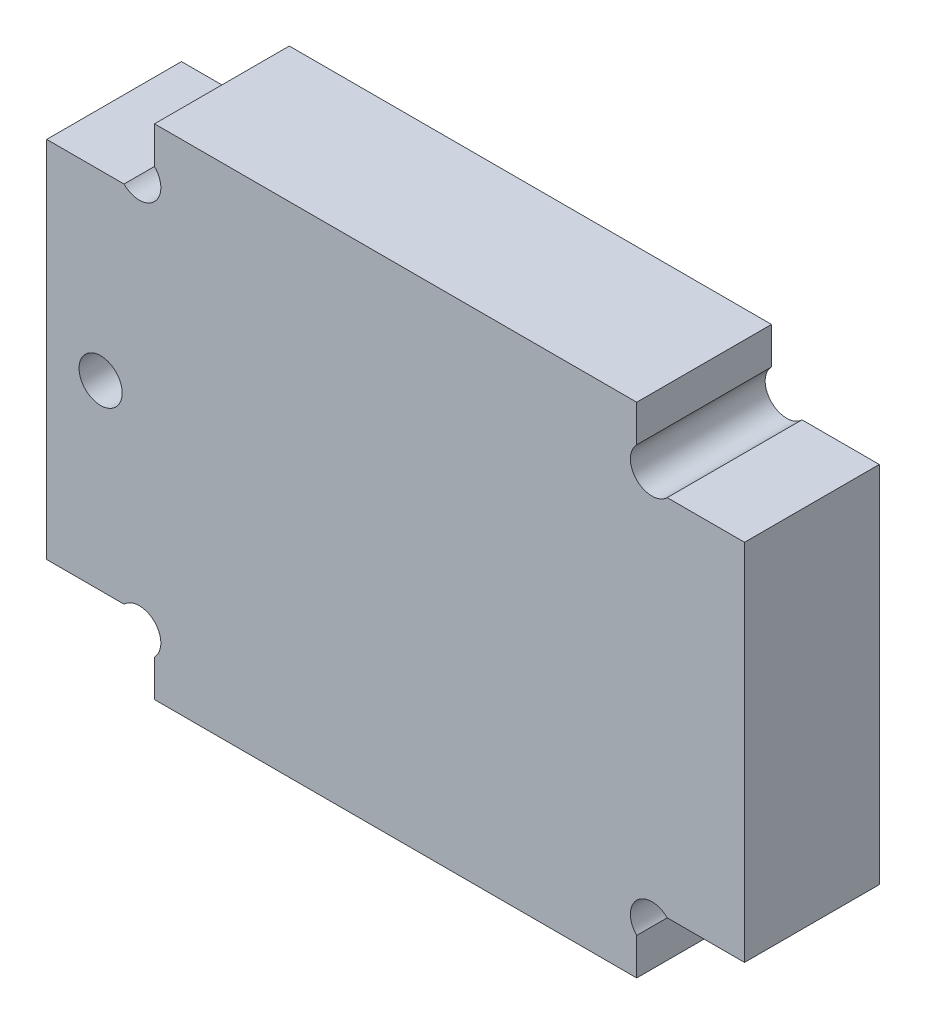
SolidWorks part; units mm, degrees
ref_plane "Plan de face" through (0, 0, 0) normal (0, 0, 1) x (1, 0, 0)
ref_plane "Plan de dessus" through (0, 0, 0) normal (0, 1, 0) x (1, 0, 0)
ref_plane "Plan de droite" through (0, 0, 0) normal (1, 0, 0) x (0, 0, -1)
sketch "Esquisse1" plane through (0, 0, 0) normal (0, 0, 1) x (1, 0, 0)
  line L0 (17.89, 18.5) -> (17.89, -18.5)
  line L1 (-17.89, 18.5) -> (17.89, 18.5)
  line L2 (-17.89, 18.5) -> (-17.89, -18.5)
  line L3 (-17.89, -18.5) -> (17.89, -18.5)
  line L5 (-17.89, 18.5) -> (17.89, -18.5) construction
  line L6 (-17.89, -18.5) -> (17.89, 18.5) construction
  point P0 (0, 0)
  dimension "D1" = 35.78
extrude "Boss.-Extru.1" add sketch "Esquisse1" along normal blind 10 contours L1 L0 L3 L2
sketch "Esquisse3" plane through (17.89, 0, 0) normal (1, 0, 0) x (0, 0, -1)
  line L0 (-10, 18.5) -> (0, 18.5) construction
  line L1 (-10, 13.5) -> (0, 13.5)
  line L2 (-10, 13.5) -> (-10, -13.5)
  line L3 (-10, -13.5) -> (0, -13.5)
  line L4 (0, 13.5) -> (0, -13.5)
  line L5 (0, 18.5) -> (0, -18.5) construction
  dimension "D1" = 10
  dimension "D2" = 27
  dimension "D3" = 5
  dimension "D4" = 0
extrude "Boss.-Extru.2" add sketch "Esquisse3" along normal blind 8
sketch "Esquisse4" plane through (-17.89, 0, 0) normal (-1, 0, 0) x (0, 0, 1)
  line L0 (0, 18.5) -> (0, -18.5) construction
  line L1 (0, 13.5) -> (10, 13.5)
  line L2 (0, 13.5) -> (0, -13.5)
  line L3 (0, -13.5) -> (10, -13.5)
  line L4 (10, 13.5) -> (10, -13.5)
  line L5 (10, 18.5) -> (0, 18.5) construction
  dimension "D1" = 10
  dimension "D2" = 5
  dimension "D3" = 27
extrude "Boss.-Extru.3" add sketch "Esquisse4" along normal blind 8
sketch "Esquisse5" plane through (0, 0, 10) normal (0, 0, 1) x (1, 0, 0)
  line L0 (-17.89, 13.5) -> (-22.368, 17.978) construction
  line L1 (-25.89, 13.5) -> (-17.89, 13.5) construction
  line L2 (-17.89, 18.5) -> (-17.89, 13.5) construction
  line L3 (-17.89, 15.7627) -> (-20.1527, 13.5)
  line L4 (0, -18.5) -> (0, 22.1261) construction
  line L5 (-17.89, -18.5) -> (17.89, -18.5) construction
  line L6 (25.89, 0) -> (-34.1231, 0) construction
  line L7 (25.89, 13.5) -> (25.89, -13.5) construction
  line L8 (17.89, 15.7627) -> (20.1527, 13.5)
  line L9 (-20.1527, -13.5) -> (-17.89, -15.7627)
  line L10 (20.1527, -13.5) -> (17.89, -15.7627)
  arc A0 (-17.89, 15.7627) -> (-20.1527, 13.5) centre (-19.0214, 14.6314) cw
  arc A1 (17.89, 15.7627) -> (20.1527, 13.5) centre (19.0214, 14.6314) ccw
  arc A2 (17.89, -15.7627) -> (20.1527, -13.5) centre (19.0214, -14.6314) cw
  arc A3 (-17.89, -15.7627) -> (-20.1527, -13.5) centre (-19.0214, -14.6314) ccw
  point P6 (-19.0214, 14.6314)
  dimension "D1" = 45
  dimension "D2" = 1.6
extrude "Enlèv. mat.-Extru.1" cut sketch "Esquisse5" against normal blind 10
sketch "Esquisse6" plane through (0, 0, 10) normal (0, 0, 1) x (1, 0, 0)
  line L0 (-27.89, 0) -> (-13.788, 0) construction
  line L1 (-21.89, -6.6485) -> (-21.89, 11.1059) construction
  line L2 (-25.89, -13.5) -> (-25.89, 13.5) construction
  circle A0 centre (-21.89, 0) radius 1.6
  dimension "D1" = 4
extrude "Enlèv. mat.-Extru.2" cut sketch "Esquisse6" against normal blind 10
